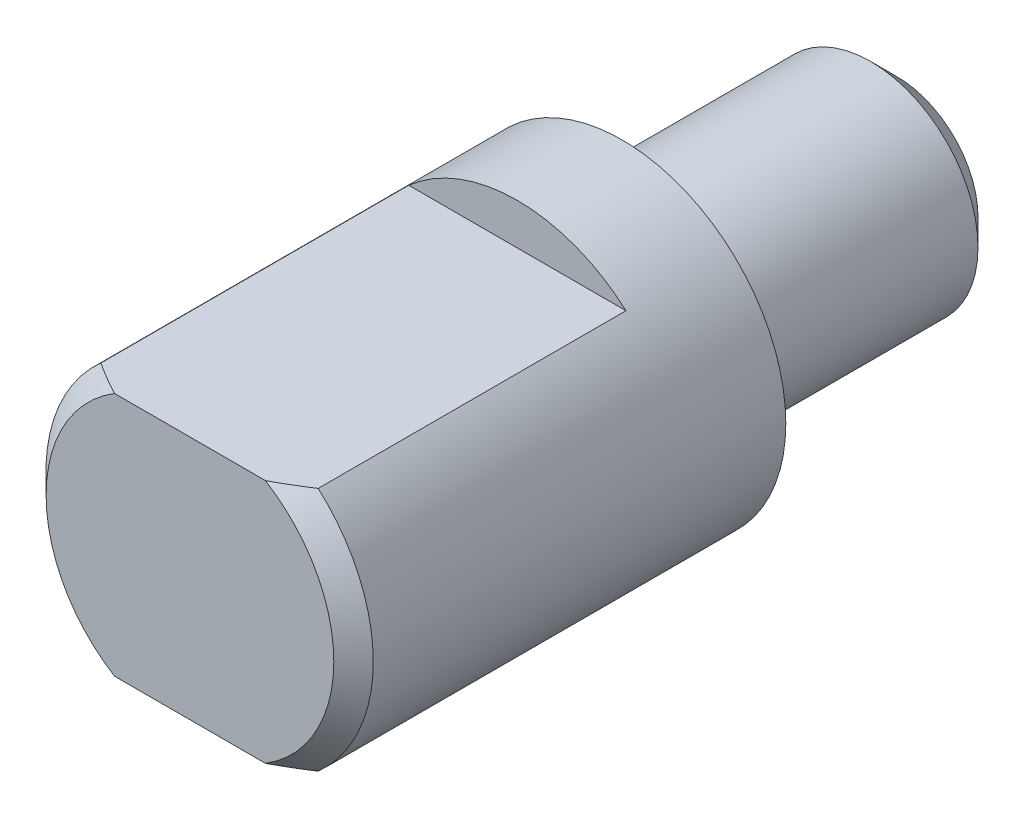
SolidWorks part; units mm, degrees
ref_plane "Front" through (0, 0, 0) normal (0, 0, 1) x (1, 0, 0)
ref_plane "Top" through (0, 0, 0) normal (0, 1, 0) x (1, 0, 0)
ref_plane "Right" through (0, 0, 0) normal (1, 0, 0) x (0, 0, -1)
sketch "Sketch1" plane through (0, 0, 0) normal (1, 0, 0) x (0, 0, -1)
  line L0 (9.648, 1.5728) -> (9.138, 2.0828)
  line L1 (-4.064, 0) -> (9.648, 0)
  line L2 (-4.064, 0) -> (-4.064, 2.79)
  line L3 (-3.684, 3.175) -> (4.318, 3.175)
  line L4 (4.318, 2.0828) -> (4.318, 3.175)
  line L5 (153.7168, 0) -> (50153.7168, 0) construction
  line L6 (-4.064, 2.79) -> (-3.684, 3.175)
  line L7 (4.318, 2.0828) -> (9.138, 2.0828)
  line L8 (9.648, 0) -> (9.648, 1.5728)
  point P2 (0, 0)
  point P12 (-8.584, 8.7614)
  dimension "D1" = 8.382
  dimension "D2" = 5.33
  dimension "D3" = 6.35
  dimension "D4" = 4.1656
  dimension "D5" = 45
  dimension "D6" = 0.51
  dimension "D7" = 2.79
  dimension "D8" = 0.38
  dimension "D9" = 4.064
revolve "Revolve1" add sketch "Sketch1" angle 360 about L1
sketch "Sketch2" plane through (0, 0, 0) normal (1, 0, 0) x (0, 0, -1)
  line L0 (-4.064, 2.79) -> (-4.064, -2.79) construction
  line L1 (-4.064, 2.375) -> (2.286, 2.375)
  line L2 (-4.064, 2.375) -> (-4.064, 3.175)
  line L3 (-4.064, 3.175) -> (2.286, 3.175)
  line L4 (2.286, 2.375) -> (2.286, 3.175)
  line L5 (4.318, 3.175) -> (-3.684, 3.175) construction
  line L6 (-4.064, 0) -> (6.0404, 0) construction
  line L7 (2.286, -2.375) -> (2.286, -3.175)
  line L8 (-4.064, -3.175) -> (2.286, -3.175)
  line L9 (-4.064, -2.375) -> (-4.064, -3.175)
  line L10 (-4.064, -2.375) -> (2.286, -2.375)
  dimension "D1" = 0.8
  dimension "D2" = 6.35
extrude "Cut-Extrude1" cut sketch "Sketch2" against normal mid plane 10
